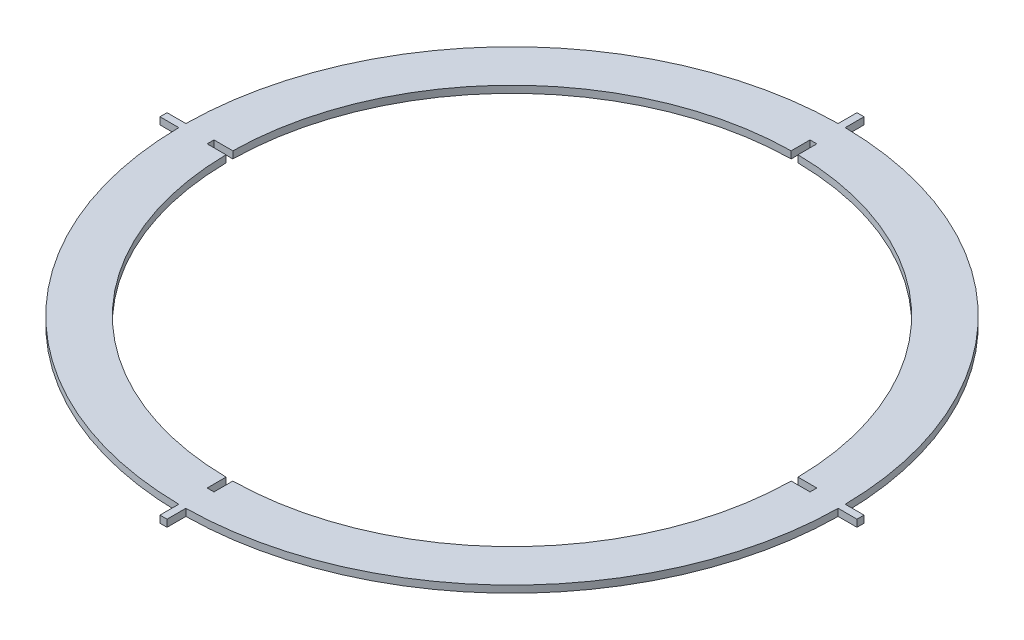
SolidWorks part; units mm, degrees
ref_plane "Front Plane" through (0, 0, 0) normal (0, 0, 1) x (1, 0, 0)
ref_plane "Top Plane" through (0, 0, 0) normal (0, 1, 0) x (1, 0, 0)
ref_plane "Right Plane" through (0, 0, 0) normal (1, 0, 0) x (0, 0, -1)
sketch "Sketch1" plane through (0, 0, 0) normal (0, 1, 0) x (1, 0, 0)
  line L0 (0, 0) -> (-29.8607, 0) construction
  line L1 (2.3553, 0) -> (0, 0) construction
  line L2 (0, 0) -> (0, -23.9022) construction
  line L3 (1.5, 87.9859) -> (1.5, 79.9859)
  line L4 (-147.992, 1.5) -> (-139.992, 1.5)
  line L5 (-147.992, 1.5) -> (-147.992, -1.5)
  line L6 (-147.992, -1.5) -> (-139.992, -1.5)
  line L7 (-1.5, 87.9859) -> (-1.5, 79.9859)
  line L8 (-127.9912, -1.45) -> (-119.9912, -1.45)
  line L9 (-127.9912, -1.45) -> (-127.9912, 1.45)
  line L10 (-127.9912, 1.45) -> (-119.9912, 1.45)
  line L11 (-1.5, 87.9859) -> (1.5, 87.9859)
  line L12 (-107.9887, -1.5) -> (-99.9887, -1.5)
  line L13 (-107.9887, -1.5) -> (-107.9887, 1.5)
  line L14 (-107.9887, 1.5) -> (-99.9887, 1.5)
  line L15 (-1.5, 107.9887) -> (-1.5, 99.9887)
  line L16 (-87.9859, -1.5) -> (-79.9859, -1.5)
  line L17 (-87.9859, -1.5) -> (-87.9859, 1.5)
  line L18 (-87.9859, 1.5) -> (-79.9859, 1.5)
  line L19 (1.5, 107.9887) -> (1.5, 99.9887)
  line L20 (-1.5, 107.9887) -> (1.5, 107.9887)
  line L21 (1.45, 127.9912) -> (1.45, 119.9912)
  line L22 (-1.45, 127.9912) -> (-1.45, 119.9912)
  line L23 (-1.45, 127.9912) -> (1.45, 127.9912)
  line L24 (1.5, 147.992) -> (1.5, 139.992)
  line L25 (-1.5, 147.992) -> (-1.5, 139.992)
  line L26 (87.9859, -1.5) -> (79.9859, -1.5)
  line L27 (87.9859, 1.5) -> (79.9859, 1.5)
  line L28 (87.9859, 1.5) -> (87.9859, -1.5)
  line L29 (107.9887, 1.5) -> (99.9887, 1.5)
  line L30 (107.9887, -1.5) -> (99.9887, -1.5)
  line L31 (107.9887, 1.5) -> (107.9887, -1.5)
  line L32 (127.9912, -1.45) -> (119.9912, -1.45)
  line L33 (127.9912, 1.45) -> (119.9912, 1.45)
  line L34 (127.9912, 1.45) -> (127.9912, -1.45)
  line L35 (147.992, -1.5) -> (139.992, -1.5)
  line L36 (147.992, 1.5) -> (139.992, 1.5)
  line L37 (-1.5, -87.9859) -> (-1.5, -79.9859)
  line L38 (1.5, -87.9859) -> (1.5, -79.9859)
  line L39 (1.5, -87.9859) -> (-1.5, -87.9859)
  line L40 (1.5, -107.9887) -> (1.5, -99.9887)
  line L41 (-1.5, -107.9887) -> (-1.5, -99.9887)
  line L42 (1.5, -107.9887) -> (-1.5, -107.9887)
  line L43 (-1.45, -127.9912) -> (-1.45, -119.9912)
  line L44 (1.45, -127.9912) -> (1.45, -119.9912)
  line L45 (1.45, -127.9912) -> (-1.45, -127.9912)
  line L46 (-1.5, -147.992) -> (-1.5, -139.992)
  line L47 (1.5, -147.992) -> (1.5, -139.992)
  line L48 (1.5, 87.9859) -> (1.5, 79.9859)
  line L49 (-1.5, 87.9859) -> (-1.5, 79.9859)
  line L50 (-1.5, 87.9859) -> (1.5, 87.9859)
  line L51 (-1.5, 107.9887) -> (-1.5, 99.9887)
  line L52 (1.5, 107.9887) -> (1.5, 99.9887)
  line L53 (-1.5, 107.9887) -> (1.5, 107.9887)
  line L54 (1.45, 127.9912) -> (1.45, 119.9912)
  line L55 (-1.45, 127.9912) -> (-1.45, 119.9912)
  line L56 (-1.45, 127.9912) -> (1.45, 127.9912)
  line L57 (1.5, 147.992) -> (1.5, 139.992)
  line L58 (-1.5, 147.992) -> (-1.5, 139.992)
  line L59 (1.5, 147.992) -> (-1.5, 147.992)
  line L60 (87.9859, -1.5) -> (79.9859, -1.5)
  line L61 (87.9859, 1.5) -> (79.9859, 1.5)
  line L62 (87.9859, 1.5) -> (87.9859, -1.5)
  line L63 (107.9887, 1.5) -> (99.9887, 1.5)
  line L64 (107.9887, -1.5) -> (99.9887, -1.5)
  line L65 (107.9887, 1.5) -> (107.9887, -1.5)
  line L66 (127.9912, -1.45) -> (119.9912, -1.45)
  line L67 (127.9912, 1.45) -> (119.9912, 1.45)
  line L68 (127.9912, 1.45) -> (127.9912, -1.45)
  line L69 (147.992, -1.5) -> (139.992, -1.5)
  line L70 (147.992, 1.5) -> (139.992, 1.5)
  line L71 (147.992, -1.5) -> (147.992, 1.5)
  line L72 (-1.5, -87.9859) -> (-1.5, -79.9859)
  line L73 (1.5, -87.9859) -> (1.5, -79.9859)
  line L74 (1.5, -87.9859) -> (-1.5, -87.9859)
  line L75 (1.5, -107.9887) -> (1.5, -99.9887)
  line L76 (-1.5, -107.9887) -> (-1.5, -99.9887)
  line L77 (1.5, -107.9887) -> (-1.5, -107.9887)
  line L78 (-1.45, -127.9912) -> (-1.45, -119.9912)
  line L79 (1.45, -127.9912) -> (1.45, -119.9912)
  line L80 (1.45, -127.9912) -> (-1.45, -127.9912)
  line L81 (-1.5, -147.992) -> (-1.5, -139.992)
  line L82 (1.5, -147.992) -> (1.5, -139.992)
  line L83 (-1.5, -147.992) -> (1.5, -147.992)
  arc A0 (-79.9859, -1.5) -> (-1.5, -79.9859) centre (0, 0) ccw
  arc A1 (-99.9887, -1.5) -> (-1.5, -99.9887) centre (0, 0) ccw
  arc A2 (-119.9912, -1.45) -> (-1.45, -119.9912) centre (0, 0) ccw
  arc A3 (-139.992, -1.5) -> (-1.5, -139.992) centre (0, 0) ccw
  arc A4 (1.5, -139.992) -> (139.992, -1.5) centre (0, 0) ccw
  arc A5 (1.45, -119.9912) -> (119.9912, -1.45) centre (0, 0) ccw
  arc A6 (1.5, -79.9859) -> (79.9859, -1.5) centre (0, 0) ccw
  arc A7 (1.5, -99.9887) -> (99.9887, -1.5) centre (0, 0) ccw
  arc A8 (-1.5, 79.9859) -> (-79.9859, 1.5) centre (0, 0) ccw
  arc A9 (-1.5, 99.9887) -> (-99.9887, 1.5) centre (0, 0) ccw
  arc A10 (-1.45, 119.9912) -> (-119.9912, 1.45) centre (0, 0) ccw
  arc A11 (-1.5, 139.992) -> (-139.992, 1.5) centre (0, 0) ccw
  arc A12 (79.9859, 1.5) -> (1.5, 79.9859) centre (0, 0) ccw
  arc A13 (99.9887, 1.5) -> (1.5, 99.9887) centre (0, 0) ccw
  arc A14 (119.9912, 1.45) -> (1.45, 119.9912) centre (0, 0) ccw
  arc A15 (139.992, 1.5) -> (1.5, 139.992) centre (0, 0) ccw
  point P71 (0, 0)
  point P97 (0, 0)
  point P146 (0, 0)
  dimension "D1" = 280
  dimension "D4" = 160
  dimension "D5" = 2.9
  dimension "D6" = 8
  dimension "D3" = 200
  dimension "D2" = 240
  dimension "D8" = 4
  dimension "D7" = 4
  dimension "D9" = 3
extrude "Boss-Extrude1" add sketch "Sketch1" along normal blind 3
